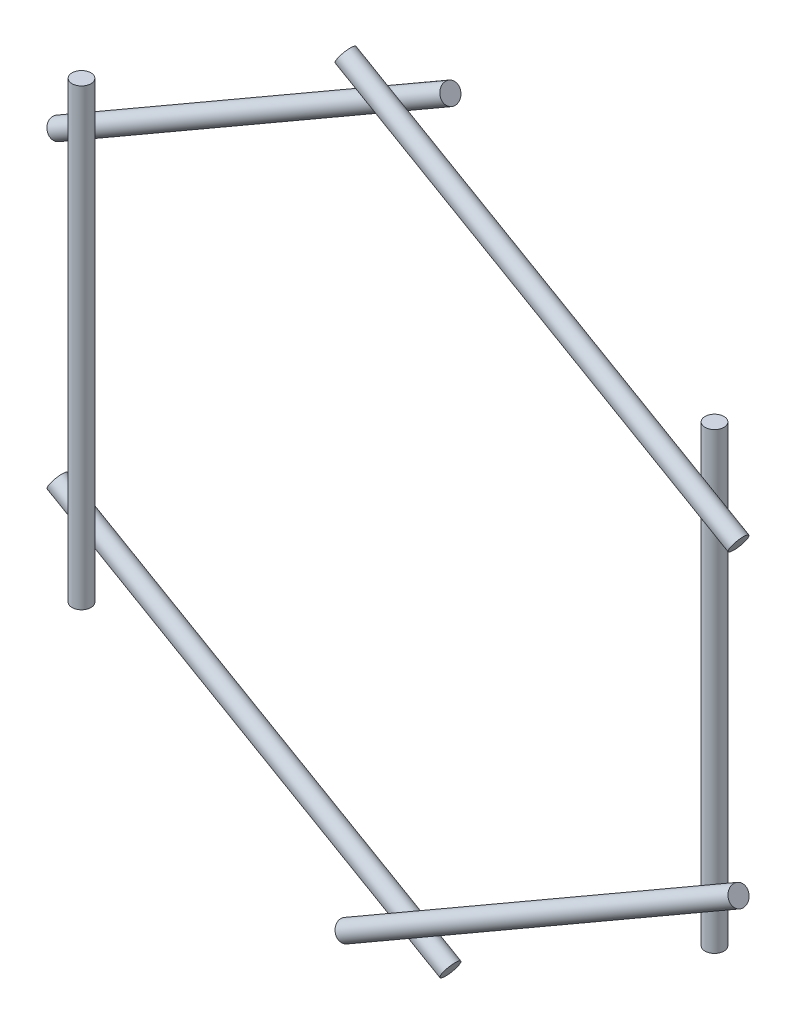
SolidWorks part; units mm, degrees
ref_plane "Front Plane" through (0, 0, 0) normal (1, 0, 0) x (0, 1, 0)
ref_plane "Top Plane" through (0, 0, 0) normal (0, 0, 1) x (0, 1, 0)
ref_plane "Right Plane" through (0, 0, 0) normal (0, 1, 0) x (-1, 0, 0)
sketch "Hex 6in Beam" plane through (0, 0, 0) normal (0, 0, 1) x (0, 1, 0)
  point P0 (0, -206.2815)
  point P1 (178.6451, -103.1408)
  point P2 (-178.6451, 103.1408)
  point P3 (178.6451, 103.1408)
  point P4 (-178.6451, -103.1408)
  point P7 (0, 206.2815)
  line B0 (76.2, 76.2) -> (215.5261, 215.5261) construction
  line B1 (-76.2, 76.2) -> (76.2, 76.2) construction
  line B2 (-76.2, 76.2) -> (-76.2, -76.2) construction
  line B3 (-76.2, -76.2) -> (76.2, -76.2) construction
  line B4 (76.2, 76.2) -> (76.2, -76.2) construction
  line B5 (-76.2, 76.2) -> (76.2, -76.2) construction
  line B6 (-76.2, -76.2) -> (76.2, 76.2) construction
  line B7 (238.1934, 0) -> (119.0967, 206.2815)
  line B8 (119.0967, 206.2815) -> (-119.0967, 206.2815)
  line B9 (-119.0967, 206.2815) -> (-238.1934, 0)
  line B10 (-238.1934, 0) -> (-119.0967, -206.2815)
  line B11 (-119.0967, -206.2815) -> (119.0967, -206.2815)
  line B12 (119.0967, -206.2815) -> (238.1934, 0)
  circle B13 centre (0, 0) radius 206.2815 construction
sketch_block_instance "Blk 6in Hex-1"
sketch_block "Blk 6in Hex" parameters "D1"=152.4, "D2"=152.4
sketch "Sketch2" plane through (0, 0, 0) normal (0, 1, 0) x (-1, 0, 0)
  circle A0 centre (-206.2815, -6.35) radius 6.35
  circle A1 centre (206.2815, 6.35) radius 6.35
  point P2 (206.2815, 0)
  point P6 (-206.2815, 0)
  dimension "D1" = 12.7
  dimension "D2" = 12.7
extrude "Boss-Extrude1" add sketch "Sketch2" along normal mid plane 304.8
sketch "Axis" plane through (0, 0, 0) normal (1, 0, 0) x (0, 1, 0)
  line L0 (0, 0) -> (0, 25)
  point P4 (0, 25)
ref_plane "n60deg Diag Plane" through (0, 0, 0) normal (-0.866, 0.5, 0) x (0, 0, 1)
sketch "Sketch4" plane through (0, 0, 0) normal (-0.866, 0.5, 0) x (0, 0, 1)
  circle A0 centre (6.35, 206.2815) radius 6.35
  circle A1 centre (-6.35, -206.2815) radius 6.35
  point P3 (0, 206.2815)
  point P11 (0, -206.2815)
  dimension "D1" = 12.7
  dimension "D2" = 12.7
extrude "Boss-Extrude2" add sketch "Sketch4" along normal mid plane 304.8 separate body
ref_plane "60deg diag plane" through (0, 0, 0) normal (-0.866, -0.5, 0) x (0, 0, 1)
sketch "Sketch5" plane through (0, 0, 0) normal (-0.866, -0.5, 0) x (0, 0, 1)
  circle A0 centre (-6.35, 206.2815) radius 6.35
  circle A1 centre (6.35, -206.2815) radius 6.35
  point P2 (0, 206.2815)
  point P6 (0, -206.2815)
  dimension "D1" = 12.7
  dimension "D2" = 12.7
extrude "Boss-Extrude3" add sketch "Sketch5" along normal mid plane 304.8 separate body
sketch "Sketch6" [suppressed] plane through (0, 0, 0) normal (0, 0, 1) x (0, 1, 0)
  line L0 (520.5967, 0) -> (260.2984, 450.85)
  line L1 (527.9291, 0) -> (263.9645, 457.2)
  line L2 (263.9645, 457.2) -> (-263.9645, 457.2)
  line L3 (-263.9645, 457.2) -> (-527.9291, 0)
  line L4 (-527.9291, 0) -> (-263.9645, -457.2)
  line L5 (-263.9645, -457.2) -> (263.9645, -457.2)
  line L6 (263.9645, -457.2) -> (527.9291, 0)
  line L7 (260.2984, 450.85) -> (-260.2984, 450.85)
  line L8 (-260.2984, 450.85) -> (-520.5967, 0)
  line L9 (-520.5967, 0) -> (-260.2984, -450.85)
  line L10 (-260.2984, -450.85) -> (260.2984, -450.85)
  line L11 (260.2984, -450.85) -> (520.5967, 0)
  circle A0 centre (0, 0) radius 457.2 construction
  circle A1 centre (513.2644, 0) radius 6.35
  circle A2 centre (256.6322, -444.5) radius 6.35
  circle A3 centre (-256.6322, -444.5) radius 6.35
  circle A4 centre (-513.2644, 0) radius 6.35
  circle A5 centre (-256.6322, 444.5) radius 6.35
  circle A6 centre (256.6322, 444.5) radius 6.35
  point P18 (0, -457.2)
  point P19 (395.9468, -228.6)
  point P29 (0, 0)
  point P30 (395.9468, 228.6)
  point P31 (0, 457.2)
  point P32 (-395.9468, 228.6)
  point P33 (-395.9468, -228.6)
  dimension "D1" = 914.4
  dimension "D3" = 12.7
  dimension "D2" = 6.35
  dimension "D4" = 6
sketch "Sketch7" [suppressed] plane through (0, 0, 0) normal (0, 1, 0) x (-1, 0, 0)
  circle A0 centre (-457.2, -6.35) radius 6.35
  circle A1 centre (457.2, 6.35) radius 6.35
  point P2 (457.2, 0)
  point P3 (-457.2, 0)
  dimension "D1" = 12.7
  dimension "D2" = 12.7
extrude "Boss-Extrude4" [suppressed] add sketch "Sketch7" along normal mid plane 558.8 separate body
sketch "Sketch8" [suppressed] plane through (0, 0, 0) normal (-0.866, 0.5, 0) x (0, 0, 1)
  circle A0 centre (6.35, 457.2) radius 6.35
  circle A1 centre (-6.35, -457.2) radius 6.35
  point P4 (0, -457.2)
  point P5 (0, 457.2)
  dimension "D1" = 12.7
  dimension "D2" = 12.7
extrude "Boss-Extrude5" [suppressed] add sketch "Sketch8" along normal mid plane 558.8 separate body
sketch "Sketch9" [suppressed] plane through (0, 0, 0) normal (-0.866, -0.5, 0) x (0, 0, 1)
  circle A0 centre (-6.35, 457.2) radius 6.35
  circle A1 centre (6.35, -457.2) radius 6.35
  point P2 (0, 457.2)
  point P6 (0, -457.2)
  dimension "D1" = 12.7
  dimension "D2" = 12.7
extrude "Boss-Extrude6" [suppressed] add sketch "Sketch9" along normal mid plane 558.8 separate body
